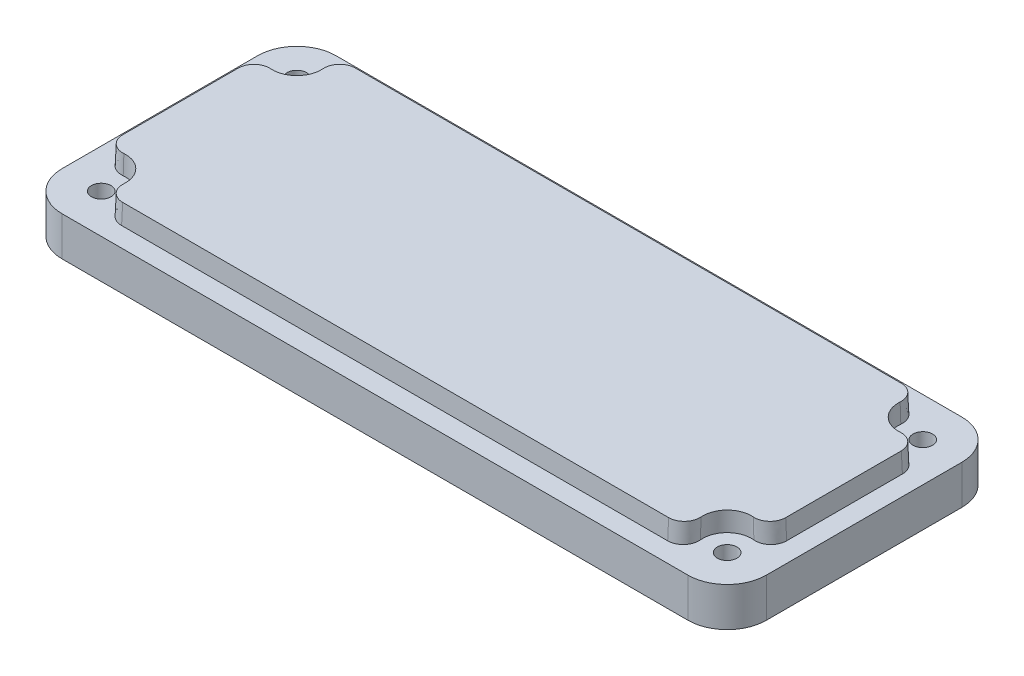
SolidWorks part; units mm, degrees
ref_plane "Front" through (0, 0, 0) normal (0, 0, 1) x (1, 0, 0)
ref_plane "Top" through (0, 0, 0) normal (0, 1, 0) x (1, 0, 0)
ref_plane "Right" through (0, 0, 0) normal (1, 0, 0) x (0, 0, -1)
sketch "Sketch1" plane through (0, 0, 0) normal (0, 1, 0) x (1, 0, 0)
  line L0 (-50.8, 22.225) -> (50.8, 22.225)
  line L1 (-57.15, 15.875) -> (-57.15, -15.875)
  line L2 (50.8, -22.225) -> (-50.8, -22.225)
  line L3 (57.15, -15.875) -> (57.15, 15.875)
  line L4 (-50.8, -15.875) -> (50.8, 15.875) construction
  arc A0 (-57.15, -15.875) -> (-50.8, -22.225) centre (-50.8, -15.875) ccw
  arc A1 (57.15, -15.875) -> (50.8, -22.225) centre (50.8, -15.875) cw
  arc A2 (50.8, 22.225) -> (57.15, 15.875) centre (50.8, 15.875) cw
  arc A3 (-50.8, 22.225) -> (-57.15, 15.875) centre (-50.8, 15.875) ccw
  dimension "D1" = 114.3
  dimension "D2" = 44.45
  dimension "D4" = 6.35
extrude "Base-Extrude" add sketch "Sketch1" along normal blind 6.35
sketch "Sketch2" plane through (0, 6.35, 0) normal (0, 1, 0) x (-1, 0, 0)
  line L4 (50.8, 19.05) -> (-50.8, 19.05)
  line L5 (-53.975, 15.875) -> (-53.975, -15.875)
  line L6 (-50.8, -19.05) -> (50.8, -19.05)
  line L7 (53.975, -15.875) -> (53.975, 15.875)
  line L8 (50.8, 19.05) -> (-50.8, 19.05)
  line L9 (-53.975, 15.875) -> (-53.975, -15.875)
  line L10 (-50.8, -19.05) -> (50.8, -19.05)
  line L11 (53.975, -15.875) -> (53.975, 15.875)
  arc A4 (53.975, 15.875) -> (50.8, 19.05) centre (50.8, 15.875) ccw
  arc A5 (53.975, 15.875) -> (50.8, 19.05) centre (50.8, 15.875) ccw
  arc A6 (-50.8, 19.05) -> (-53.975, 15.875) centre (-50.8, 15.875) ccw
  arc A7 (-50.8, 19.05) -> (-53.975, 15.875) centre (-50.8, 15.875) ccw
  arc A8 (-53.975, -15.875) -> (-50.8, -19.05) centre (-50.8, -15.875) ccw
  arc A9 (-53.975, -15.875) -> (-50.8, -19.05) centre (-50.8, -15.875) ccw
  arc A10 (50.8, -19.05) -> (53.975, -15.875) centre (50.8, -15.875) ccw
  arc A11 (50.8, -19.05) -> (53.975, -15.875) centre (50.8, -15.875) ccw
  dimension "D1" = 3.175
extrude "Boss-Extrude1" add sketch "Sketch2" along normal blind 3.175 draft 3
sketch "Sketch3" plane through (0, 9.525, 0) normal (0, 1, 0) x (-1, 0, 0)
  circle A0 centre (-50.8, 15.875) radius 3.9687
  dimension "D1" = 7.9375
extrude "Cut-Extrude1" cut sketch "Sketch3" against normal up to surface (3.175 mm away)
sketch "Sketch4" plane through (0, 6.35, 0) normal (0, 1, 0) x (-1, 0, 0)
  circle A0 centre (-50.8, 15.875) radius 1.5875
  dimension "D1" = 3.175
extrude "Cut-Extrude2" cut sketch "Sketch4" against normal through all
mirror "Mirror1" about plane through (0, 0, 0) normal (0, 0, 1) of "Cut-Extrude2", "Cut-Extrude1"
mirror "Mirror2" about plane through (0, 0, 0) normal (1, 0, 0) of "Mirror1", "Cut-Extrude1", "Cut-Extrude2"
fillet "Fillet1" radius 2.54 8 edges at (53.8935, 7.9044, 13.3888) (48.3138, 7.9044, 18.9685) (53.8935, 7.9044, -13.3888) (48.3138, 7.9044, -18.9685) (-53.8935, 7.9044, -13.3888) (-48.3138, 7.9044, -18.9685) (-48.3138, 7.9044, 18.9685) (-53.8935, 7.9044, 13.3888)
fillet "Fillet2" radius 0.7937
sketch "Sketch5" plane through (0, 0, 0) normal (0, -1, 0) x (1, 0, 0)
  line L0 (-44.45, 15.875) -> (44.45, 15.875)
  line L1 (-44.45, 15.875) -> (-44.45, -15.875)
  line L2 (44.45, -15.875) -> (-44.45, -15.875)
  line L3 (44.45, -15.875) -> (44.45, 15.875)
  line L4 (50.8, 22.225) -> (-50.8, 22.225) construction
  line L5 (57.15, 15.875) -> (57.15, -15.875) construction
  line L6 (-57.15, -15.875) -> (-57.15, 15.875) construction
  line L7 (-50.8, -22.225) -> (50.8, -22.225) construction
  dimension "D1" = 6.35
  dimension "D2" = 12.7
  dimension "D3" = 12.7
  dimension "D4" = 6.35
extrude "Cut-Extrude3" cut sketch "Sketch5" against normal blind 6.35 draft 3
fillet "Fillet3" radius 6.35 4 edges at (-44.2836, 3.175, -15.7086) (-44.2836, 3.175, 15.7086) (44.2836, 3.175, 15.7086) (44.2836, 3.175, -15.7086)
fillet "Fillet4" radius 3.175
